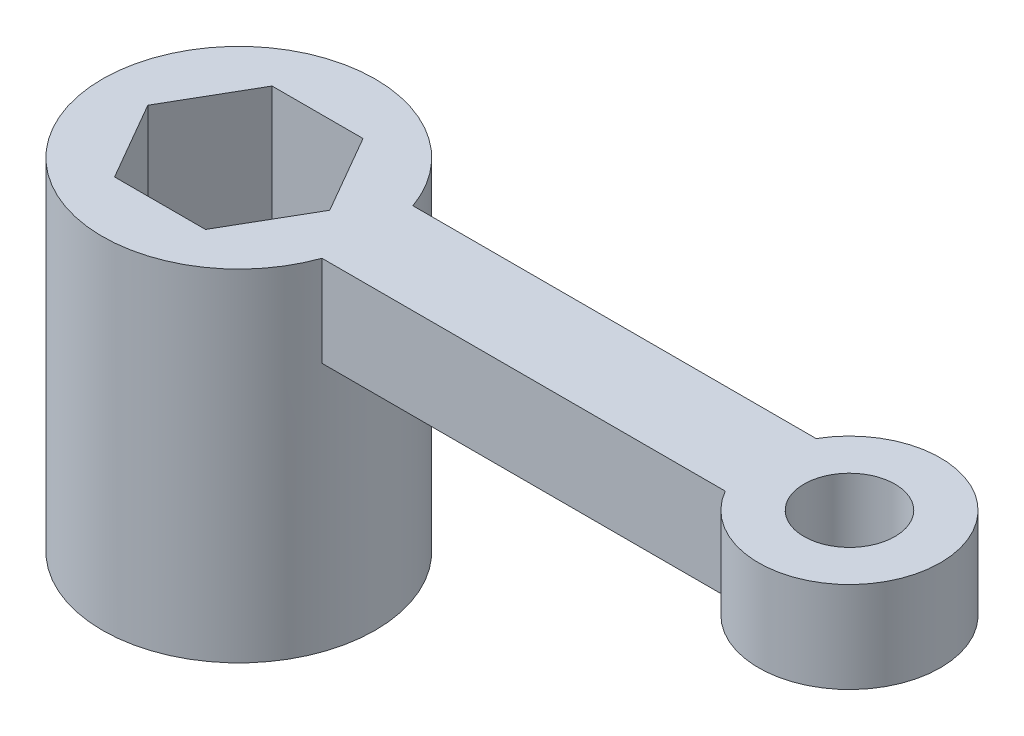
SolidWorks part; units mm, degrees
ref_plane "Front Plane" through (0, 0, 0) normal (0, 0, 1) x (1, 0, 0)
ref_plane "Top Plane" through (0, 0, 0) normal (0, 1, 0) x (1, 0, 0)
ref_plane "Right Plane" through (0, 0, 0) normal (1, 0, 0) x (0, 0, -1)
sketch "Sketch1" plane through (0, 0, 0) normal (0, 1, 0) x (1, 0, 0)
  circle A0 centre (0, 0) radius 3.3572 construction
  circle A1 centre (6.7143, 0) radius 3.3572 construction
  dimension "D1" = 6.7143
sketch "Sketch2" plane through (0, 0, 0) normal (0, 1, 0) x (1, 0, 0)
  line L0 (5.8483, 0.5) -> (1.4142, 0.5)
  line L1 (1, 0) -> (0.5, 0.866)
  line L2 (0.5, 0.866) -> (-0.5, 0.866)
  line L3 (-0.5, 0.866) -> (-1, 0)
  line L4 (-1, 0) -> (-0.5, -0.866)
  line L5 (-0.5, -0.866) -> (0.5, -0.866)
  line L6 (0.5, -0.866) -> (1, 0)
  line L7 (1.4142, -0.5) -> (5.8483, -0.5)
  arc A0 (1.4142, 0.5) -> (1.4142, -0.5) centre (0, 0) ccw
  circle A1 centre (6.7143, 0) radius 0.5
  arc A2 (5.8483, -0.5) -> (5.8483, 0.5) centre (6.7143, 0) ccw
  circle A3 centre (0, 0) radius 1 construction
  dimension "D1" = 1
  dimension "D2" = 2
  dimension "D3" = 2
  dimension "D4" = 3
  dimension "D5" = 1
extrude "Boss-Extrude1" add sketch "Sketch2" along normal blind 1 contours L7 A2 L0 A0 L6 L5 L4 L3 L2 L1 A1
sketch "Sketch3" plane through (0, 0, 0) normal (0, -1, 0) x (1, 0, 0)
  line L1 (1, 0) -> (0.5, -0.866) construction
  line L2 (1, 0) -> (0.5, -0.866)
  line L3 (0.5, 0.866) -> (1, 0) construction
  line L4 (-0.5, 0.866) -> (0.5, 0.866) construction
  line L5 (-1, 0) -> (-0.5, 0.866) construction
  line L6 (-0.5, -0.866) -> (-1, 0) construction
  line L7 (0.5, -0.866) -> (-0.5, -0.866) construction
  line L8 (0.5, 0.866) -> (1, 0)
  line L9 (-0.5, 0.866) -> (0.5, 0.866)
  line L10 (-1, 0) -> (-0.5, 0.866)
  line L11 (-0.5, -0.866) -> (-1, 0)
  line L12 (0.5, -0.866) -> (-0.5, -0.866)
  circle A0 centre (0, 0) radius 1.5
  arc A1 (1.4142, 0.5) -> (1.4142, -0.5) centre (0, 0) ccw construction
extrude "Boss-Extrude2" add sketch "Sketch3" along normal blind 2.75
